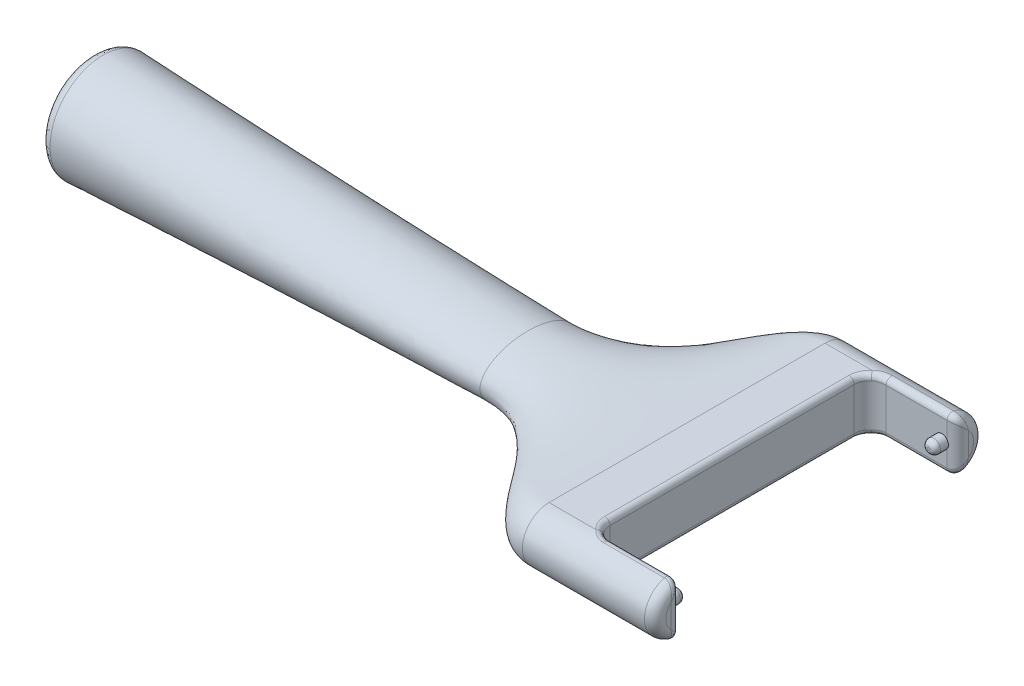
SolidWorks part; units mm, degrees
ref_plane "Front Plane" through (0, 0, 0) normal (0, 0, 1) x (1, 0, 0)
ref_plane "Top Plane" through (0, 0, 0) normal (0, 1, 0) x (1, 0, 0)
ref_plane "Right Plane" through (0, 0, 0) normal (1, 0, 0) x (0, 0, -1)
body saved out of another part "Stock-Wheels with train base-1"
